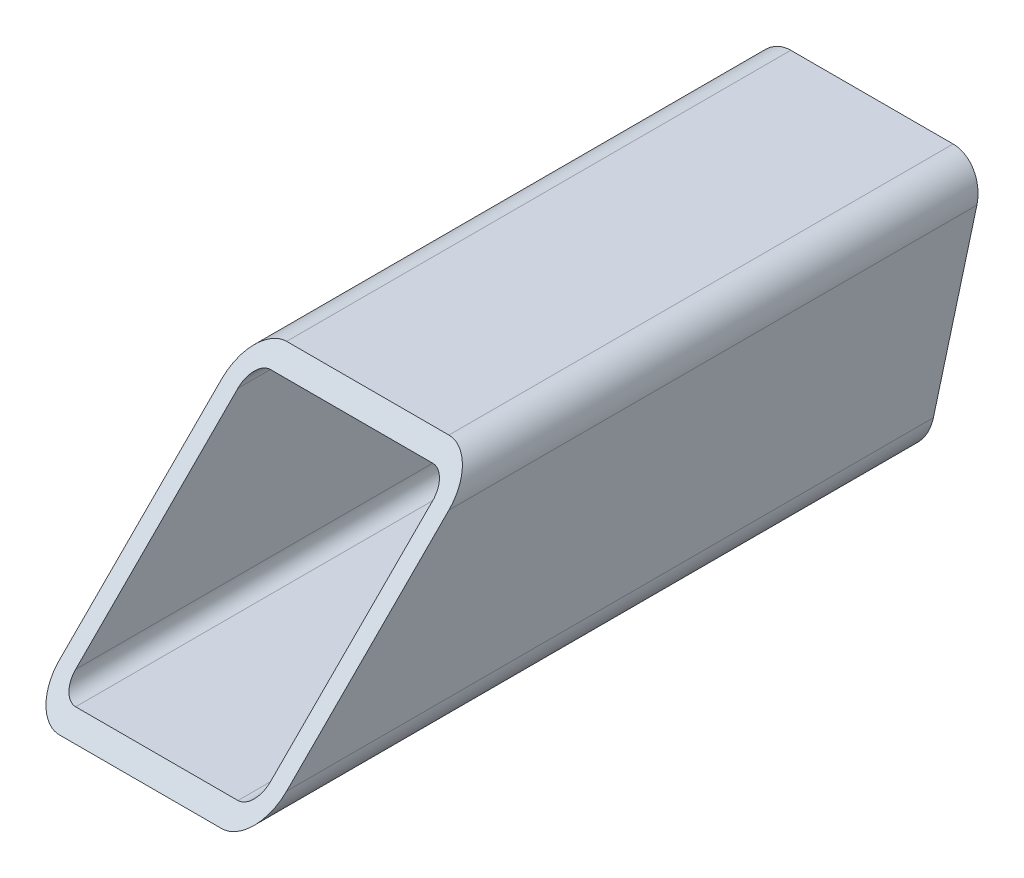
SolidWorks part; units mm, degrees
ref_plane "Plan de face" through (0, 0, 0) normal (0, 0, 1) x (1, 0, 0)
ref_plane "Plan de dessus" through (0, 0, 0) normal (0, 1, 0) x (1, 0, 0)
ref_plane "Plan de droite" through (0, 0, 0) normal (1, 0, 0) x (0, 0, -1)
sketch "Esquisse1" plane through (0, 0, 0) normal (0, 0, 1) x (1, 0, 0)
  line L0 (-25, 30) -> (25, 30)
  line L1 (-25, 35) -> (25, 35)
  line L2 (-35, 25) -> (-35, -25)
  line L3 (-25, -35) -> (25, -35)
  line L4 (35, 25) -> (35, -25)
  line L5 (30, 25) -> (30, -25)
  line L6 (-25, -30) -> (25, -30)
  line L7 (-30, 25) -> (-30, -25)
  arc A0 (-25, 35) -> (-35, 25) centre (-25, 25) ccw
  arc A1 (25, 35) -> (35, 25) centre (25, 25) cw
  arc A2 (-25, -35) -> (-35, -25) centre (-25, -25) cw
  arc A3 (25, -35) -> (35, -25) centre (25, -25) ccw
  arc A4 (25, 30) -> (30, 25) centre (25, 25) cw
  arc A5 (25, -30) -> (30, -25) centre (25, -25) ccw
  arc A6 (-25, -30) -> (-30, -25) centre (-25, -25) cw
  arc A7 (-25, 30) -> (-30, 25) centre (-25, 25) ccw
  point P26 (35, 0)
  point P28 (0, 35)
  dimension "D1" = 10
  dimension "D2" = 10
  dimension "D3" = 10
  dimension "D4" = 70
  dimension "D5" = 70
  dimension "D6" = 5
extrude "Boss.-Extru.1" add sketch "Esquisse1" along normal blind 230
sketch "Esquisse3" plane through (-35, 0, 0) normal (-1, 0, 0) x (0, 0, 1)
  line L0 (0, 35) -> (18.7564, -35)
  line L1 (0, 25) -> (0, -25) construction
  line L2 (230, -35) -> (0, -35) construction
  line L3 (225.3214, -35) -> (155.3214, 35)
  line L4 (230, 35) -> (0, 35) construction
  line L7 (18.7564, -35) -> (0, -35)
  line L8 (0, -35) -> (0, 35)
  line L9 (155.3214, 35) -> (230, 35)
  line L10 (230, 35) -> (230, -35)
  line L11 (230, -35) -> (225.3214, -35)
  point P5 (225.3214, -35)
  dimension "D1" = 15
  dimension "D2" = 206.565
  dimension "D3" = 45
extrude "Enlèv. mat.-Extru.1" cut sketch "Esquisse3" against normal blind 250
